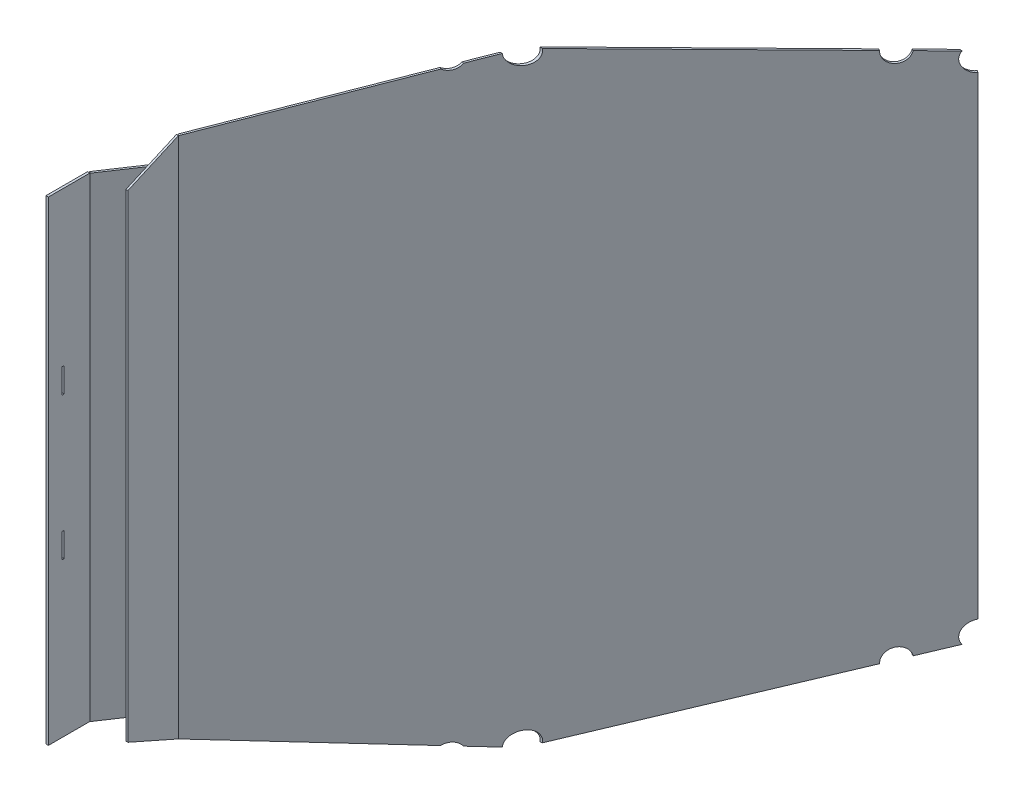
SolidWorks part; units mm, degrees
ref_plane "X-Y Datum" through (0, 0, 0) normal (0, 0, 1) x (1, 0, 0)
ref_plane "X-Z Datum" through (0, 0, 0) normal (0, 1, 0) x (1, 0, 0)
ref_plane "Y-Z Datum" through (0, 0, 0) normal (1, 0, 0) x (0, 0, -1)
ref_plane "Plane2" through (251.4767, 0, 168.3074) normal (-0.831, 0, -0.5562) x (-0.5562, 0, 0.831)
sketch "Sketch3" plane through (251.4767, 0, 168.3074) normal (-0.831, 0, -0.5562) x (-0.5562, 0, 0.831)
  line L0 (-187.2045, -273.05) -> (-187.2045, 273.05)
  line L1 (-187.2045, 273.05) -> (164.4025, 323.85)
  line L2 (429.2995, -279.4) -> (429.2995, -254)
  line L3 (429.2995, 279.4) -> (164.4025, 323.85)
  line L4 (-187.2045, 0) -> (429.2995, 0)
  line L5 (429.2995, -279.4) -> (164.4025, -323.85)
  line L6 (-187.2045, -273.05) -> (164.4025, -323.85)
  line L7 (429.2995, -254) -> (497.2625, -254)
  line L9 (55, 0) -> (-55, 0) construction
  line L10 (429.2995, 254) -> (497.2625, 254)
  line L11 (497.2625, 254) -> (497.2625, -254)
  line L12 (429.2995, 254) -> (429.2995, 279.4)
  dimension "D1" = 273.05
  dimension "D2" = 279.4
  dimension "D3" = 323.85
  dimension "D4" = 25.4
extrude "Boss-Extrude1" add sketch "Sketch3" along normal blind 2.159 contours L0 L4 L2 L3 L1 | L0 L6 L5 L2 L4
ref_plane "Plane3" through (12.7, 0, 0) normal (-1, 0, 0) x (0, 0, 1)
sketch "Sketch4" plane through (12.7, 0, 0) normal (-1, 0, 0) x (0, 0, 1)
  line L2 (525.0759, -279.4) -> (525.0759, 279.4)
  line L3 (525.0759, 279.4) -> (579.0509, 255.5299)
  line L5 (579.0509, 255.5299) -> (579.0509, -255.5299)
  line L6 (525.0759, -279.4) -> (579.0509, -255.5299)
  dimension "D1" = 53.975
extrude "Boss-Extrude2" add sketch "Sketch4" along normal blind 2.159 separate body
ref_plane "Plane4" through (825.5, 177.8, 47.625) normal (-0.9802, 0.1844, -0.0728) x (-0.0715, 0.0135, 0.9973)
sketch "Sketch5" plane through (825.5, 177.8, 47.625) normal (-0.9802, 0.1844, -0.0728) x (-0.0715, 0.0135, 0.9973)
  circle A0 centre (0, 0) radius 12.954
  dimension "D1" = 25.908
extrude "Cut-Extrude1" cut sketch "Sketch5" along normal blind 621.665
ref_plane "Plane5" through (825.5, 227.0125, 304.8) normal (-0.8987, 0.1001, -0.4271) x (-0.4245, 0.0473, 0.9042)
sketch "Sketch6" plane through (825.5, 227.0125, 304.8) normal (-0.8987, 0.1001, -0.4271) x (-0.4245, 0.0473, 0.9042)
  circle A0 centre (0, 0) radius 12.954
  dimension "D1" = 25.908
extrude "Cut-Extrude2" cut sketch "Sketch6" along normal through all
ref_plane "Plane6" through (825.5, 227.0125, 304.8) normal (-0.9902, 0.1398, -0.0002) x (-0.0002, 0, 1)
sketch "Sketch7" plane through (825.5, 227.0125, 304.8) normal (-0.9902, 0.1398, -0.0002) x (-0.0002, 0, 1)
  circle A0 centre (0, 0) radius 12.954
  dimension "D1" = 25.908
extrude "Cut-Extrude3" cut sketch "Sketch7" along normal through all
ref_plane "Plane7" through (825.5, 220.2924, 603.4647) normal (-0.9311, 0.1391, -0.3371) x (-0.3334, 0.0498, 0.9415)
sketch "Sketch8" plane through (825.5, 220.2924, 603.4647) normal (-0.9311, 0.1391, -0.3371) x (-0.3334, 0.0498, 0.9415)
  circle A0 centre (0, 0) radius 12.954
  dimension "D1" = 25.908
extrude "Cut-Extrude4" cut sketch "Sketch8" along normal through all
mirror "Mirror1" about plane through (0, 0, 0) normal (0, 1, 0) of "Cut-Extrude4", "Cut-Extrude3", "Cut-Extrude2", "Cut-Extrude1"
ref_plane "Plane9" through (-25.4, 0, 0) normal (1, 0, 0) x (0, 0, -1)
sketch "Sketch10" plane through (-25.4, 0, 0) normal (1, 0, 0) x (0, 0, -1)
  line L0 (-581.5564, 254) -> (-581.5564, -254) construction
  line L1 (-581.5564, 254) -> (-581.5564, -254)
  line L2 (-581.5564, 254) -> (-626.0064, 254)
  line L3 (-581.5564, -254) -> (-626.0064, -254)
  line L4 (-626.0064, 254) -> (-626.0064, -254)
  line L13 (-609.1326, 63.1148) -> (-609.1326, 89.3994)
  line L14 (-609.1326, 89.3994) -> (-611.6788, 89.3994)
  line L15 (-611.6788, 89.3994) -> (-611.6788, 63.1148)
  line L16 (-611.6788, 63.1148) -> (-609.1326, 63.1148)
  line L21 (210.3724, 0) -> (-210.3724, 0) construction
  line L22 (-611.6788, -63.1148) -> (-609.1326, -63.1148)
  line L23 (-609.1326, -89.3994) -> (-611.6788, -89.3994)
  line L24 (-609.1326, -63.1148) -> (-609.1326, -89.3994)
  line L25 (-611.6788, -89.3994) -> (-611.6788, -63.1148)
  dimension "D1" = 44.45
extrude "Boss-Extrude3" add sketch "Sketch10" against normal blind 2.54 separate body
